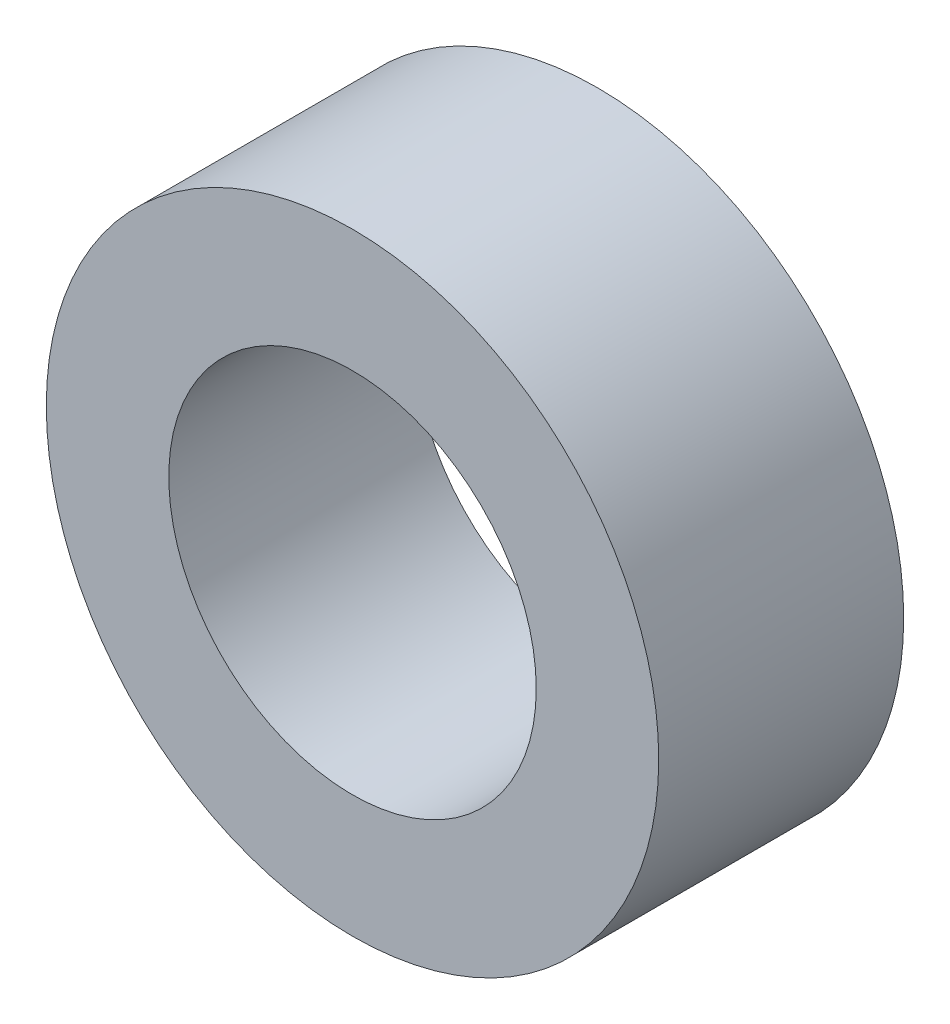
SolidWorks part; units mm, degrees
ref_plane "Front Plane" through (0, 0, 0) normal (0, 0, 1) x (1, 0, 0)
ref_plane "Top Plane" through (0, 0, 0) normal (0, 1, 0) x (1, 0, 0)
ref_plane "Right Plane" through (0, 0, 0) normal (1, 0, 0) x (0, 0, -1)
sketch "Sketch1" plane through (0, 0, 0) normal (0, 0, 1) x (1, 0, 0)
  circle A0 centre (0, 0) radius 4.7625
  circle A1 centre (0, 0) radius 7.9375
  dimension "D1" = 15.875
  dimension "D2" = 9.525
extrude "Boss-Extrude1" add sketch "Sketch1" along normal blind 6.35
